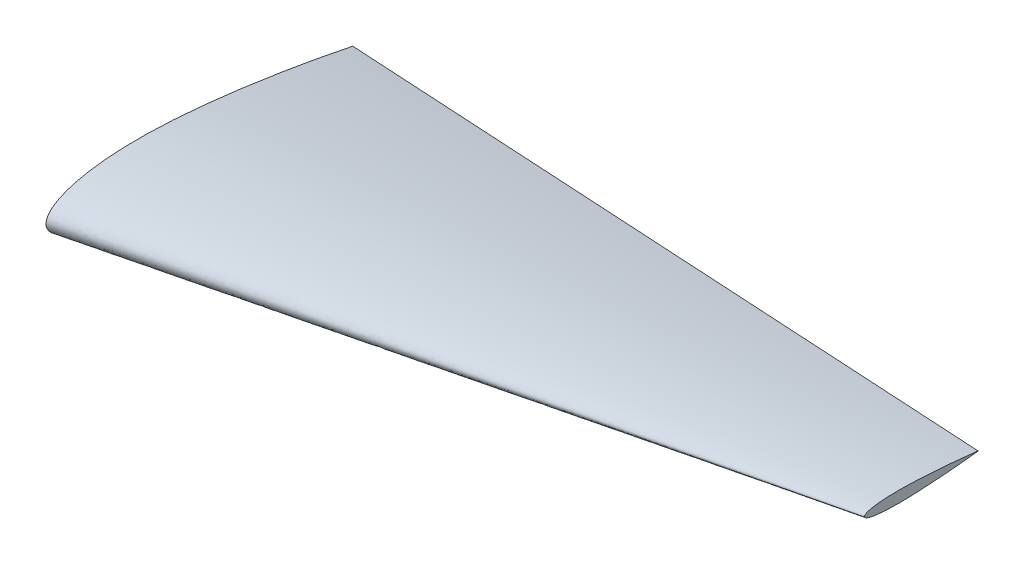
SolidWorks part; units mm, degrees
ref_plane "Front Plane" through (0, 0, 0) normal (0, 0, 1) x (1, 0, 0)
ref_plane "Top Plane" through (0, 0, 0) normal (0, 1, 0) x (1, 0, 0)
ref_plane "Right Plane" through (0, 0, 0) normal (1, 0, 0) x (0, 0, -1)
ref_plane "Root" through (1219.2, 0, 0) normal (1, 0, 0) x (0, 0, -1)
sketch "Sketch1" plane through (1219.2, 0, 0) normal (1, 0, 0) x (0, 0, -1)
sketch_block_instance "Block-NACA_0018-1"
sketch_block "Block-NACA_0018"
ref_plane "Tip" through (14935.2, 0, 0) normal (1, 0, 0) x (0, 0, -1)
sketch "Sketch2" plane through (14935.2, 0, 0) normal (1, 0, 0) x (0, 0, -1)
  point P0 (2222.5, 812.8)
  dimension "D1" = 2222.5
  dimension "D2" = 812.8
sketch_block_instance "Block-NACA_0010-1"
sketch_block "Block1"
loft "Loft1" add profiles "Sketch1", "Sketch2"
